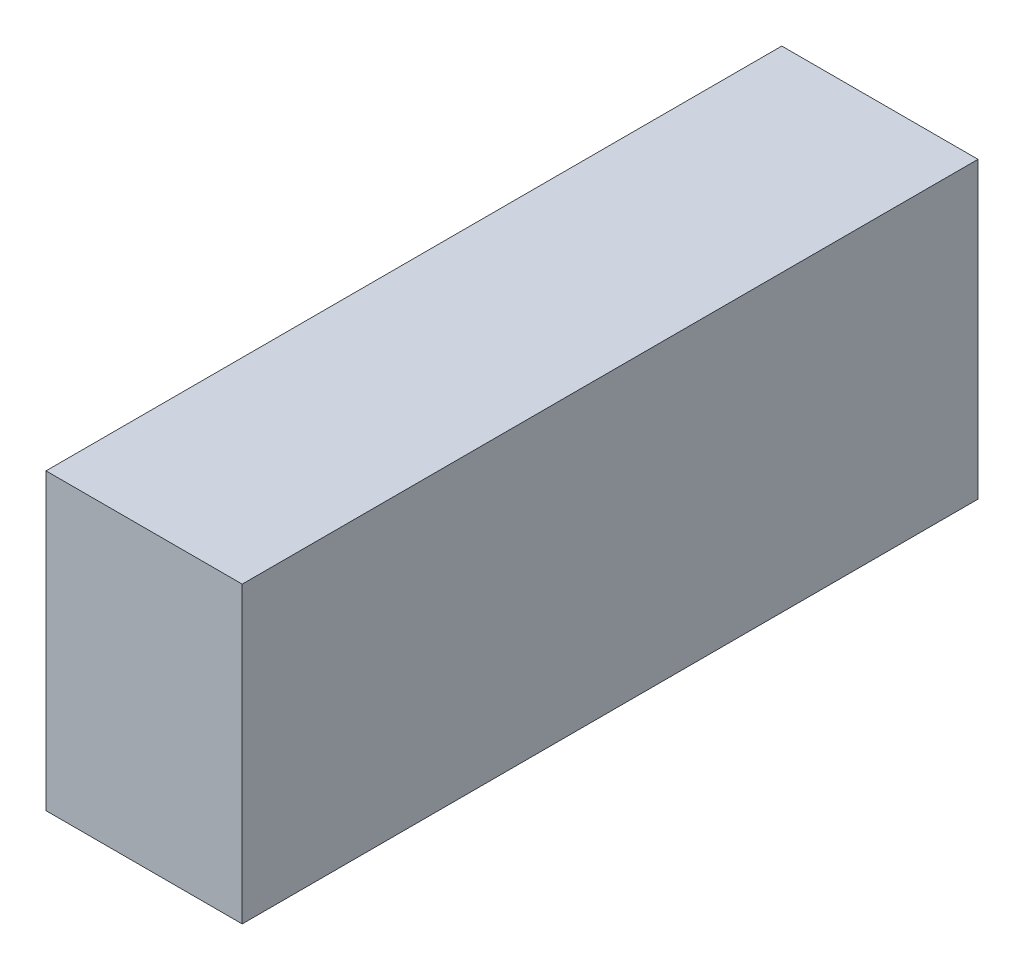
SolidWorks part; units mm, degrees
ref_plane "Front Plane" through (0, 0, 0) normal (0, 0, 1) x (1, 0, 0)
ref_plane "Top Plane" through (0, 0, 0) normal (0, 1, 0) x (1, 0, 0)
ref_plane "Right Plane" through (0, 0, 0) normal (1, 0, 0) x (0, 0, -1)
sketch "Sketch1" plane through (0, 0, 0) normal (0, 1, 0) x (1, 0, 0)
  line L1 (0, 0) -> (4, 0)
  line L2 (0, 0) -> (0, -15)
  line L3 (0, -15) -> (4, -15)
  line L4 (4, 0) -> (4, -15)
  dimension "D1" = 15
  dimension "D2" = 4
extrude "Boss-Extrude1" add sketch "Sketch1" along normal blind 6
